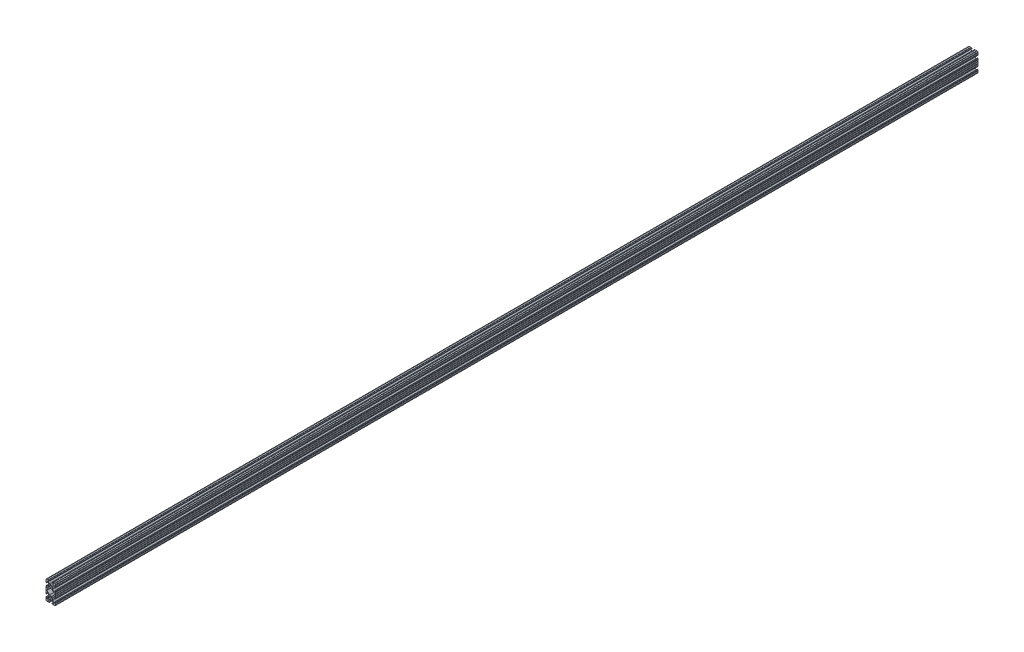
SolidWorks part; units mm, degrees
ref_plane "Front Plane" through (0, 0, 0) normal (0, 0, 1) x (1, 0, 0)
ref_plane "Top Plane" through (0, 0, 0) normal (0, 1, 0) x (1, 0, 0)
ref_plane "Right Plane" through (0, 0, 0) normal (1, 0, 0) x (0, 0, -1)
sketch "Sketch2" plane through (0, 0, 0) normal (0, 0, 1) x (1, 0, 0)
  line L0 (0, 25.4) -> (0, -25.4) construction
  line L1 (-12.7, 0) -> (12.7, 0) construction
  line L2 (3.2512, -25.4) -> (12.7, -25.4)
  line L3 (12.7, -25.4) -> (12.7, -15.9512)
  line L4 (3.2512, -25.4) -> (3.2512, -23.1902)
  line L5 (3.2512, -23.1902) -> (8.9276, -23.1902)
  line L6 (8.9276, -23.1902) -> (3.0856, -17.3482)
  line L7 (0, -12.7) -> (12.7, -25.4) construction
  line L8 (12.7, -15.9512) -> (10.4902, -15.9512)
  line L9 (10.4902, -15.9512) -> (10.4902, -21.6276)
  line L10 (10.4902, -21.6276) -> (4.6482, -15.7856)
  line L11 (3.2512, -25.4) -> (0, -25.4) construction
  line L12 (0, -25.4) -> (-3.2512, -25.4) construction
  line L13 (-3.2512, -25.4) -> (-12.7, -25.4) construction
  line L14 (12.7, 25.4) -> (-12.7, 25.4) construction
  line L15 (0, 12.7) -> (0, -12.7) construction
  circle A0 centre (0, -12.7) radius 2.6035
  arc A1 (6.3485, -23.1902) -> (7.1039, -21.3665) centre (6.3485, -22.1219) ccw construction
  point P8 (0, -17.3482)
  point P16 (-2.6035, -12.7)
  point P18 (2.6035, -12.7)
  point P19 (0, -10.0965)
  point P20 (0, -15.3035)
  point P27 (-12.7, -25.4)
  point P30 (0, 25.4)
  point P31 (12.7, 25.4)
  point P32 (-12.7, 25.4)
  point P33 (12.7, -25.4)
  point P34 (0, -12.7)
  point P35 (0, 12.7)
  point P37 (0, 0)
  point P38 (-3.2512, -25.4)
  point P39 (3.2512, -25.4)
sketch "Sketch3" plane through (0, 0, 0) normal (1, 0, 0) x (0, 0, -1)
  line L0 (-1219.2, -25.4) -> (1219.2, -25.4) construction
  line L1 (-1168.4, 0) -> (1168.4, 0) construction
  point P6 (-1219.2, -25.4)
  point P8 (-1168.4, 0)
  point P9 (1168.4, 0)
  point P10 (1219.2, -25.4)
sketch "Sketch4" plane through (0, 0, 0) normal (0, 0, 1) x (1, 0, 0)
  line L0 (4.1904, -25.4) -> (10.1173, -25.4)
  line L1 (3.2512, -25.4) -> (12.7, -25.4) construction
  line L2 (3.2512, -25.4) -> (3.2512, -23.1902) construction
  line L3 (3.2512, -23.1902) -> (8.9276, -23.1902) construction
  line L4 (3.2512, -24.1294) -> (3.2512, -24.4608)
  line L5 (4.1904, -23.1902) -> (6.3485, -23.1902)
  line L6 (0, -17.3482) -> (2.164, -17.3482)
  line L7 (8.9276, -23.1902) -> (3.0856, -17.3482) construction
  line L8 (3.7373, -17.9999) -> (7.1039, -21.3665)
  line L9 (12.7, -25.4) -> (12.7, -15.9512) construction
  line L10 (10.4902, -21.6276) -> (4.6482, -15.7856) construction
  line L11 (10.4902, -15.9512) -> (10.4902, -21.6276) construction
  line L12 (10.4902, -19.0485) -> (10.4902, -16.8904)
  line L13 (12.7, -15.9512) -> (10.4902, -15.9512) construction
  line L14 (11.4294, -15.9512) -> (11.7608, -15.9512)
  line L15 (12.7, -16.8904) -> (12.7, -22.8173)
  line L16 (8.6665, -19.8039) -> (5.2999, -16.4373)
  line L17 (4.6482, -12.7) -> (4.6482, -14.864)
  line L19 (0, -17.3482) -> (0, -15.3035)
  line L20 (0, 25.4) -> (0, -25.4) construction
  line L21 (4.6482, -12.7) -> (2.6035, -12.7)
  arc A0 (3.2512, -24.4608) -> (4.1904, -25.4) centre (4.1904, -24.4608) ccw
  circle A1 centre (0, -12.7) radius 2.6035 construction
  arc A2 (3.2512, -24.1294) -> (4.1904, -23.1902) centre (4.1904, -24.1294) cw
  arc A3 (6.3485, -23.1902) -> (7.1039, -21.3665) centre (6.3485, -22.1219) ccw
  arc A4 (2.164, -17.3482) -> (3.7373, -17.9999) centre (2.164, -19.5732) cw
  arc A5 (10.1173, -25.4) -> (12.7, -22.8173) centre (10.1173, -22.8173) ccw
  arc A6 (8.6665, -19.8039) -> (10.4902, -19.0485) centre (9.4219, -19.0485) ccw
  arc A7 (10.4902, -16.8904) -> (11.4294, -15.9512) centre (11.4294, -16.8904) cw
  arc A8 (11.7608, -15.9512) -> (12.7, -16.8904) centre (11.7608, -16.8904) cw
  arc A9 (5.2999, -16.4373) -> (4.6482, -14.864) centre (6.8732, -14.864) cw
  arc A11 (0, -15.3035) -> (2.6035, -12.7) centre (0, -12.7) ccw
extrude "Boss-Extrude1" add sketch "Sketch4" along normal mid plane 2438.4
sketch "Sketch5" plane through (0, 0, 0) normal (0, 0, 1) x (1, 0, 0)
  line L0 (3.2512, -25.4) -> (12.7, -25.4) construction
  line L1 (4.1904, -23.1902) -> (6.3485, -23.1902) construction
  line L3 (0, -12.7) -> (12.7, -25.4) construction
  line L4 (6.3485, -23.1902) -> (6.3485, -25.4) construction
  line L5 (8.9276, -23.1902) -> (3.0856, -17.3482) construction
  circle A0 centre (10.3562, -25.4) radius 0.5524
  circle A1 centre (5.796, -25.4) radius 0.5524
  circle A2 centre (12.7, -23.0562) radius 0.5524
  circle A3 centre (12.7, -18.496) radius 0.5524
  point P10 (5.2694, -23.1902)
  point P12 (9.4219, -19.0485)
extrude "Cut-Extrude1" cut sketch "Sketch5" against normal through all both and the other way through all
mirror "Mirror1" about plane through (4.6482, -12.7, 1219.2) normal (0, -1, 0)
sketch "Sketch6" plane through (0, 0, 0) normal (0, 0, 1) x (1, 0, 0)
  line L0 (12.7, -1.7914) -> (12.7, 0)
  line L1 (12.7, 0) -> (9.8037, 0)
  line L2 (-12.7, 0) -> (12.7, 0) construction
  line L3 (9.8037, 0) -> (9.8037, -2.3438)
  line L4 (9.8037, -2.3438) -> (12.1476, -2.3438)
  circle A0 centre (12.7, -2.3438) radius 0.5524 construction
  arc A1 (12.7, -1.7914) -> (12.1476, -2.3438) centre (12.7, -2.3438) ccw
  arc A4 (12.58, -1.8046) -> (12.7, -2.8963) centre (12.7, -2.3438) ccw construction
  arc A6 (9.8037, 0) -> (10.8954, -0.12) centre (10.3562, 0) ccw construction
extrude "Boss-Extrude2" add sketch "Sketch6" along normal mid plane 2438.4
sketch "Sketch7" plane through (0, 0, 0) normal (0, 0, 1) x (1, 0, 0)
  line L0 (5.4206, -5.7168) -> (10.3284, -0.809)
  line L1 (3.7373, -7.4001) -> (7.1039, -4.0335) construction
  line L2 (10.4902, -0.4184) -> (10.4902, 0)
  line L3 (0, 0) -> (10.4902, 0)
  line L4 (-12.7, 0) -> (12.7, 0) construction
  line L5 (0, 0) -> (5.4206, -5.7168)
  arc A0 (10.3284, -0.809) -> (10.4902, -0.4184) centre (9.9377, -0.4184) ccw
  arc A3 (12.7, -1.7914) -> (12.7, -2.8963) centre (12.7, -2.3438) ccw construction
extrude "Cut-Extrude2" cut sketch "Sketch7" against normal through all both and the other way through all
mirror "Mirror2" about plane through (0, 0, 0) normal (0, 1, 0)
mirror "Mirror3" about plane through (0, 0, 0) normal (1, 0, 0)
equation "\"D1@Boss-Extrude1\"=\"Length@Sketch3\""
equation "\"D1@Sketch2\"=\"Thickness@Sketch2\""
equation "\"D2@Sketch4\"=\"Slot Inner Width@Sketch2\"*0.15"
equation "\"D1@Sketch4\"=\"D3@Sketch4\"*2.75"
equation "\"D3@Sketch4\"=\"Thickness@Sketch2\"*0.425"
equation "\"D1@Sketch5\"=\"Thickness@Sketch2\"*0.5"
equation "\"D1@Boss-Extrude2\"=\"Length@Sketch3\""
